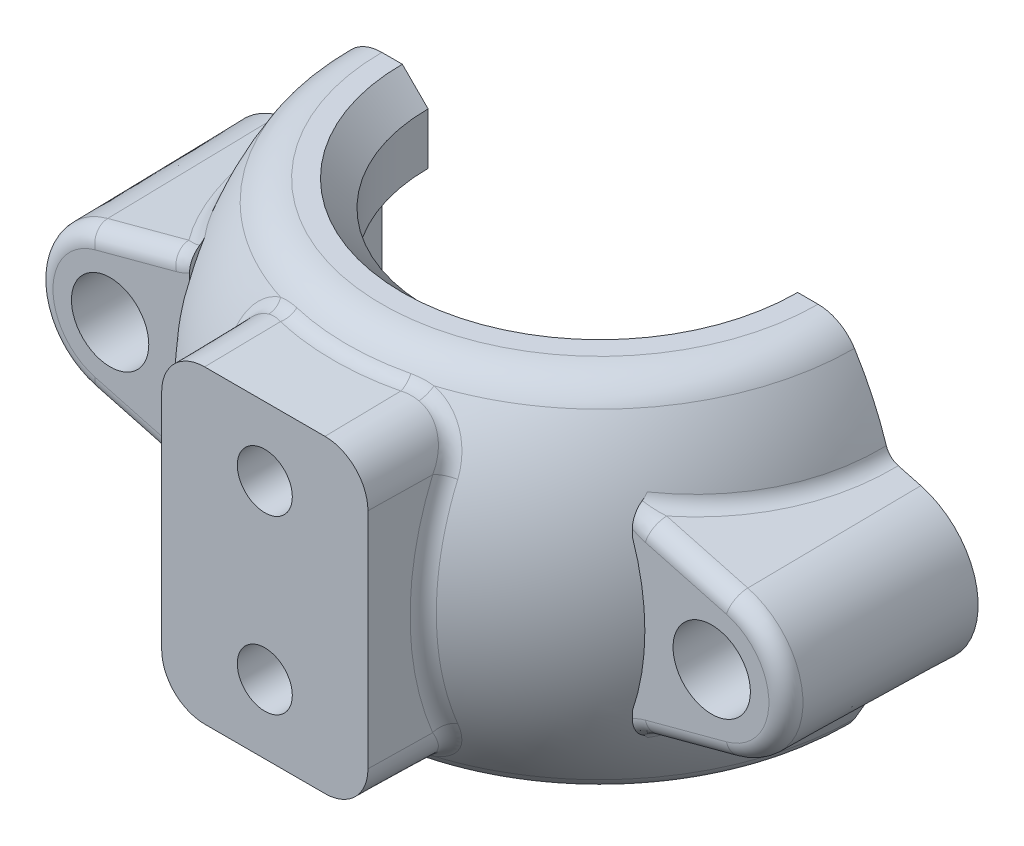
SolidWorks part; units mm, degrees
ref_plane "Plan1" through (0, 0, 0) normal (0, 0, 1) x (1, 0, 0)
ref_plane "Plan2" through (0, 0, 0) normal (0, 1, 0) x (1, 0, 0)
ref_plane "Plan3" through (0, 0, 0) normal (1, 0, 0) x (0, 0, -1)
sketch "Esquisse4" plane through (0, 0, 0) normal (0, 0, 1) x (1, 0, 0)
  line L0 (23, 21) -> (20, 18)
  line L1 (23, 21) -> (25.3772, 21)
  line L2 (23, -21) -> (25.3772, -21)
  line L4 (0, -27.5) -> (0, 30) construction
  line L5 (20, 18) -> (20, 12)
  line L6 (20, 12) -> (26, 12)
  line L7 (26, 12) -> (26, -12)
  line L8 (26, -12) -> (20, -12)
  line L9 (20, -12) -> (20, -18)
  line L10 (20, -18) -> (23, -21)
  arc A2 (29.6067, -18.6667) -> (32.8625, -12.0439) centre (0, 0) ccw
  arc A5 (32.8625, -12.0439) -> (29.6067, 18.6667) centre (0, 0) ccw
  arc A9 (29.6067, 18.6667) -> (25.3772, 21) centre (25.3772, 16) ccw
  arc A12 (25.3772, -21) -> (29.6067, -18.6667) centre (25.3772, -16) ccw
revolve "Base-Révolution" add sketch "Esquisse4" angle 180 about L4
sketch "Esquisse5" plane through (0, 0, 0) normal (0, 0, -1) x (-1, 0, 0)
  line L0 (0, 25) -> (0, -27.5) construction
  line L1 (0, -27.5) -> (0, -85) construction
  line L2 (-50, 0) -> (-14.5805, 0) construction
  line L3 (25.3772, 11.8959) -> (25.3772, -11.8959)
  line L4 (48, 0) -> (-57, 0) construction
  line L5 (-25.3772, 11.8959) -> (-25.3772, -11.8959)
  line L6 (-48, 0) -> (57, 0) construction
  line L7 (37.3294, 8.6933) -> (25.3772, 11.8959)
  line L8 (37.3294, -8.6933) -> (25.3772, -11.8959)
  line L9 (-37.3294, 8.6933) -> (-25.3772, 11.8959)
  line L10 (-37.3294, -8.6933) -> (-25.3772, -11.8959)
  arc A0 (-37.3294, 8.6933) -> (-37.3294, -8.6933) centre (-35, 0) ccw
  arc A1 (37.3294, 8.6933) -> (37.3294, -8.6933) centre (35, 0) cw
  dimension "D1" = 18
  dimension "D2" = 70
  dimension "D3" = 15
  dimension "D4" = 15
  dimension "D5" = 15
  dimension "D6" = 15
extrude "Boss.-Extru.1" add sketch "Esquisse5" against normal blind 22 draft 1
sketch "Esquisse7" plane through (0, 0, 22) normal (0, 0, 1) x (1, 0, 0)
  circle A0 centre (35, 0) radius 4.5
  circle A1 centre (-35, 0) radius 4.5
  arc A2 (37.23, -8.3224) -> (37.23, 8.3224) centre (35, 0) ccw construction
  arc A3 (-37.23, 8.3224) -> (-37.23, -8.3224) centre (-35, 0) ccw construction
  dimension "D1" = 9
  dimension "D2" = 9
extrude "Enlèv. mat.-Extru.2" cut sketch "Esquisse7" against normal through all
fillet "Congé2" radius 2
fillet "Congé3" radius 2
ref_plane "Plan4" through (0, 0, 39) normal (0, 0, -1) x (-1, 0, 0)
sketch "Esquisse8" plane through (0, 0, 39) normal (0, 0, -1) x (-1, 0, 0)
  line L0 (-7, 18) -> (7, 18)
  line L1 (-12, 13) -> (-12, -13)
  line L2 (7, -18) -> (-7, -18)
  line L3 (12, -13) -> (12, 13)
  arc A0 (-7, 18) -> (-12, 13) centre (-7, 13) ccw
  arc A1 (12, 13) -> (7, 18) centre (7, 13) ccw
  arc A2 (7, -18) -> (12, -13) centre (7, -13) ccw
  arc A3 (-7, -18) -> (-12, -13) centre (-7, -13) cw
  point P7 (-12, 18)
  point P10 (12, 18)
  point P13 (12, -18)
  dimension "D5" = 5
  dimension "D1" = 24
  dimension "D2" = 36
  dimension "D3" = 18
  dimension "D4" = 12
extrude "Boss.-Extru.2" add sketch "Esquisse8" along normal up to next draft 1
fillet "Congé4" radius 2
sketch "Esquisse9" plane through (0, 0, 39) normal (0, 0, 1) x (1, 0, 0)
  line L0 (-16, 0) -> (17, 0) construction
  circle A0 centre (0, 10) radius 3.2
  circle A1 centre (0, -10) radius 3.2
  dimension "D1" = 6.4
  dimension "D2" = 20
extrude "Enlèv. mat.-Extru.3" cut sketch "Esquisse9" against normal through all
sketch "Esquisse10" plane through (0, 0, 0) normal (0, 0, -1) x (-1, 0, 0)
  line L0 (-10, 0) -> (15, 0) construction
  line L1 (-8, 8) -> (-8, -8)
  line L2 (8, 8) -> (8, -8)
  arc A0 (8, 8) -> (-8, 8) centre (0, 8) ccw
  arc A1 (8, -8) -> (-8, -8) centre (0, -8) cw
  dimension "D1" = 16
  dimension "D2" = 16
extrude "Enlèv. mat.-Extru.4" cut sketch "Esquisse10" against normal blind 27
sketch "Esquisse11" plane through (0, 0, 27) normal (0, 0, -1) x (-1, 0, 0)
  line L0 (-11, 0) -> (14, 0) construction
  circle A0 centre (0, 10) radius 6
  circle A1 centre (0, -10) radius 6
  dimension "D1" = 12
extrude "Enlèv. mat.-Extru.5" cut sketch "Esquisse11" against normal blind 7
fillet "Congé6" radius 2
